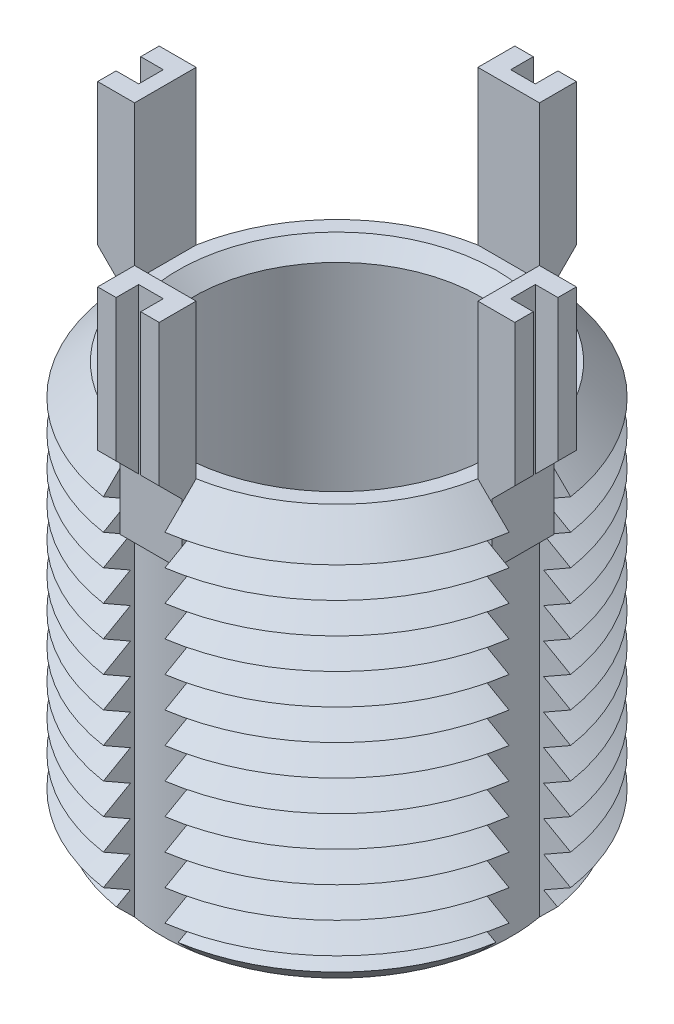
SolidWorks part; units mm, degrees
ref_plane "Front Plane" through (0, 0, 0) normal (0, 0, 1) x (1, 0, 0)
ref_plane "Top Plane" through (0, 0, 0) normal (0, 1, 0) x (1, 0, 0)
ref_plane "Right Plane" through (0, 0, 0) normal (1, 0, 0) x (0, 0, -1)
sketch "Sketch1" plane through (0, 0, 0) normal (0, 1, 0) x (1, 0, 0)
  circle A0 centre (0, 0) radius 10
  dimension "D1" = 20
extrude "Boss-Extrude1" add sketch "Sketch1" against normal blind 20
chamfer "Chamfer1" distance 1.5 angle 45 2 edges at (0, -20, 10) (0, 0, 10)
sketch "Sketch2" plane through (0, 0, 0) normal (1, 0, 0) x (0, 0, -1)
  line L0 (0, 0.8859) -> (0, -9.2617) construction
sketch "Sketch3" plane through (0, 0, 0) normal (1, 0, 0) x (0, 0, -1)
  line L0 (-10, -1.5) -> (-8.701, -2.25)
  line L1 (-8.701, -2.25) -> (-10, -3)
  line L2 (-10, -1.5) -> (-10, -18.5) construction
  line L3 (-10, -3) -> (-10, -1.5)
  dimension "D1" = 1.5
revolve "Cut-Revolve1" cut sketch "Sketch3" angle 360 about L0
pattern_linear "LPattern1" count 12 spacing 1.5 along (0, -1, 0) of "Cut-Revolve1"
sketch "Sketch4" plane through (0, 0, 0) normal (0, 1, 0) x (1, 0, 0)
  line L0 (-8.3666, 1.5) -> (-9.8869, 1.5)
  line L2 (-9.8869, -1.5) -> (-8.3666, -1.5)
  arc A0 (-8.3666, 1.5) -> (-8.3666, -1.5) centre (0, 0) ccw
  arc A1 (-9.8869, 1.5) -> (-9.8869, -1.5) centre (0, 0) ccw
  circle A2 centre (0, 0) radius 10 construction
  circle A3 centre (0, 0) radius 8.5 construction
  point P1 (-8.5, 0)
  point P3 (-10, 0)
  point P13 (0, 0)
  dimension "D1" = 3
extrude "Cut-Extrude1" cut sketch "Sketch4" against normal up to surface (20 mm away)
pattern_circular "CirPattern1" count 4 over 360 about axis through (0, 0, 0) along (0, 1, 0) of "Cut-Extrude1"
sketch "Sketch5" plane through (0, 0, 0) normal (1, 0, 0) x (0, 0, -1)
  line L0 (-8.3666, 7.5) -> (-8.3666, -3.5)
  line L1 (-8.3666, -3.5) -> (-9.0666, -3.5)
  line L2 (-9.0666, -3.5) -> (-9.0666, -0.5)
  line L3 (-9.0666, -0.5) -> (-10.1666, 0.6)
  line L4 (-10.1666, 0.6) -> (-10.1666, 7.5)
  line L5 (-10.1666, 7.5) -> (-8.3666, 7.5)
  line L6 (-9.8869, -4.5) -> (-1.5, -4.5) construction
  point P9 (-1.5, 0)
  point P10 (-9.0666, -0.5)
  dimension "D1" = 1
  dimension "D2" = 11
  dimension "D3" = 8
  dimension "D4" = 1.8
  dimension "D5" = 0.7
  dimension "D6" = 45
extrude "Boss-Extrude3" add sketch "Sketch5" along normal mid plane 3
pattern_circular "CirPattern2" count 4 over 360 about axis through (0, 0, 0) along (0, 1, 0) of "Boss-Extrude3"
sketch "Sketch6" plane through (0, 7.5, 0) normal (0, 1, 0) x (1, 0, 0)
  line L0 (-10.1666, -1.5) -> (-10.1666, 1.5) construction
  line L1 (-10.1666, -0.6) -> (-9.0666, -0.6)
  line L2 (-10.1666, -0.6) -> (-10.1666, 0.6)
  line L3 (-10.1666, 0.6) -> (-9.0666, 0.6)
  line L4 (-9.0666, -0.6) -> (-9.0666, 0.6)
  line L5 (-10.1666, -0.6) -> (-9.0666, 0.6) construction
  line L6 (-10.1666, 0.6) -> (-9.0666, -0.6) construction
  line L7 (10.1666, 1.5) -> (10.1666, -1.5) construction
  line L8 (-0.6, 9.0666) -> (0.6, 9.0666)
  line L9 (-0.6, 9.0666) -> (-0.6, 10.1666)
  line L10 (-0.6, 10.1666) -> (0.6, 10.1666)
  line L11 (0.6, 9.0666) -> (0.6, 10.1666)
  line L12 (-0.6, 9.0666) -> (0.6, 10.1666) construction
  line L13 (-0.6, 10.1666) -> (0.6, 9.0666) construction
  line L14 (9.0666, -0.6) -> (10.1666, -0.6)
  line L15 (9.0666, -0.6) -> (9.0666, 0.6)
  line L16 (9.0666, 0.6) -> (10.1666, 0.6)
  line L17 (10.1666, -0.6) -> (10.1666, 0.6)
  line L18 (9.0666, -0.6) -> (10.1666, 0.6) construction
  line L19 (9.0666, 0.6) -> (10.1666, -0.6) construction
  line L20 (-0.6, -10.1666) -> (0.6, -10.1666)
  line L21 (-0.6, -10.1666) -> (-0.6, -9.0666)
  line L22 (-0.6, -9.0666) -> (0.6, -9.0666)
  line L23 (0.6, -10.1666) -> (0.6, -9.0666)
  line L24 (-0.6, -10.1666) -> (0.6, -9.0666) construction
  line L25 (-0.6, -9.0666) -> (0.6, -10.1666) construction
  line L26 (-1.5, 10.1666) -> (1.5, 10.1666) construction
  line L27 (1.5, -10.1666) -> (-1.5, -10.1666) construction
  point P0 (-9.6166, 0)
  point P7 (-10.1666, 0)
  point P8 (-10.1666, 0)
  point P9 (0, 9.6166)
  point P14 (9.6166, 0)
  point P19 (0, -9.6166)
  point P24 (0, 10.1666)
  point P25 (10.1666, 0)
  point P26 (10.1666, 0)
  point P27 (0, 10.1666)
  point P30 (0, -10.1666)
  point P33 (0, -10.1666)
  dimension "D1" = 1.2
  dimension "D2" = 1.1
extrude "Cut-Extrude3" cut sketch "Sketch6" against normal through all both and the other way through all
sketch "Sketch7" plane through (0, 0, 0) normal (0, 1, 0) x (1, 0, 0)
  circle A0 centre (0, 0) radius 7
  dimension "D1" = 14
extrude "Cut-Extrude4" cut sketch "Sketch7" against normal up to surface (20 mm away)
chamfer "Chamfer2" distance 0.75 angle 45 2 edges at (0, 0, 7) (0, -20, 7)
